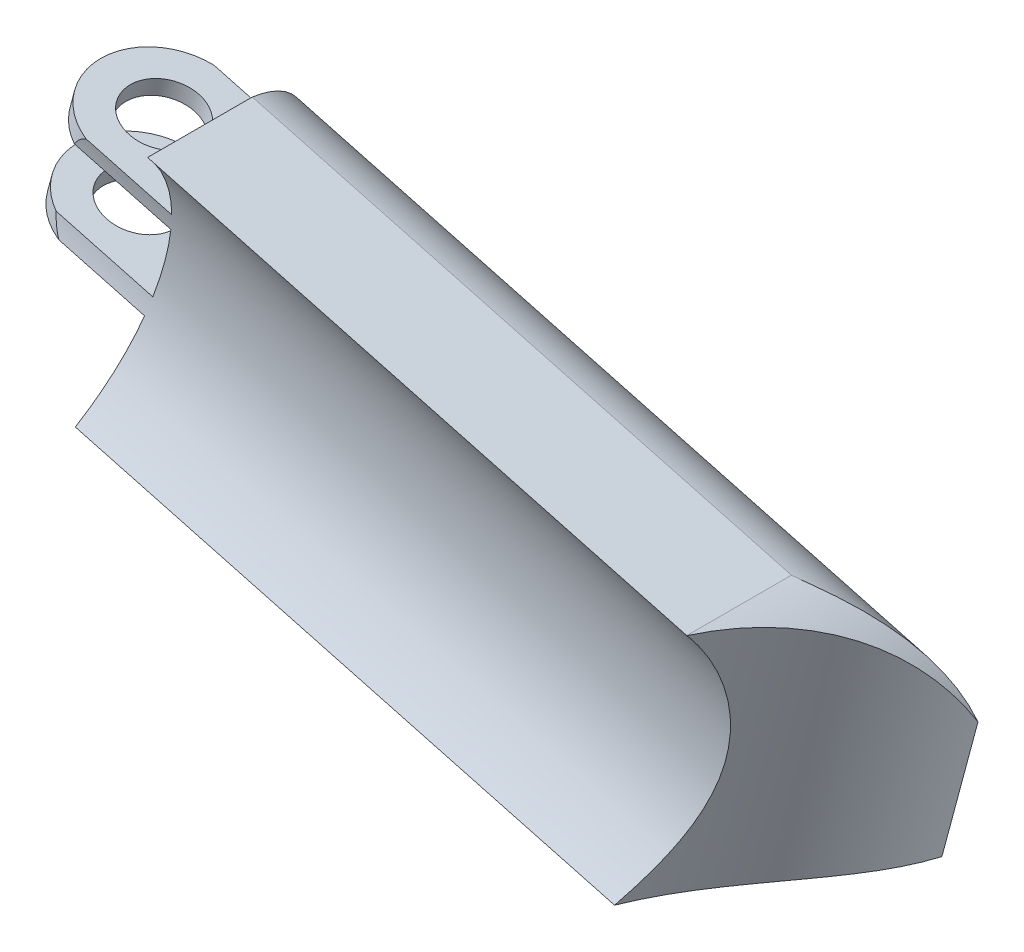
SolidWorks part; units mm, degrees
ref_plane "Front Plane" through (0, 0, 0) normal (0, 0, 1) x (1, 0, 0)
ref_plane "Top Plane" through (0, 0, 0) normal (0, 1, 0) x (1, 0, 0)
ref_plane "Right Plane" through (0, 0, 0) normal (1, 0, 0) x (0, 0, -1)
sketch "草图1" plane through (0, 0, 0) normal (0, 0, 1) x (1, 0, 0)
  line L0 (-16.6893, 10.3528) -> (21.9478, 0)
  line L1 (-16.6893, 10.3528) -> (-20.8304, -5.1021)
  line L2 (-20.8304, -5.1021) -> (17.8067, -15.4548)
  line L3 (17.8067, -15.4548) -> (21.9478, 0)
  dimension "D1" = 40
extrude "凸台-拉伸1" add sketch "草图1" along normal blind 10
sketch "草图2" plane through (-18.1595, 4.8658, 0) normal (-0.9659, 0.2588, 0) x (0, 0, 1)
  line L0 (0, 5.6805) -> (0, -10.3195) construction
  line L1 (10, 5.6805) -> (0, 5.6805) construction
  line L2 (10, -10.3195) -> (0, -10.3195) construction
  line L3 (4, 5.6805) -> (4, 12.3845)
  line L4 (4, 12.3845) -> (-14.9046, 12.3845)
  line L5 (-14.9046, 12.3845) -> (-14.9046, -20.0885)
  line L6 (-14.9046, -20.0885) -> (4, -20.0885)
  line L7 (4, -20.0885) -> (4, -10.3195)
  arc A0 (0, 1.6805) -> (4, 5.6805) centre (4.9155, 0.765) cw
  arc A1 (4, -10.3195) -> (0, -6.3195) centre (4.9155, -5.404) cw
  dimension "D1" = 4
  dimension "D3" = 4
  dimension "D2" = 4
extrude "切除-拉伸1" cut sketch "草图2" against normal blind 40 and the other way through all
sketch "草图3" plane through (-18.1595, 4.8658, 0) normal (-0.9659, 0.2588, 0) x (0, 0, 1)
  line L0 (10, 5.6805) -> (10, -10.3195)
  arc A0 (10, 5.6805) -> (10, -10.3195) centre (18.9443, -2.3195) ccw
extrude "切除-拉伸2" cut sketch "草图3" against normal blind 40
sketch "草图4" plane through (-18.1595, 4.8658, 0) normal (-0.9659, 0.2588, 0) x (0, 0, 1)
  line L0 (7.3253, 0.6805) -> (0, 0.6805)
  line L1 (0, 1.6805) -> (0, -6.3195) construction
  line L2 (0, 0.6805) -> (0, -0.3195)
  line L3 (0, -0.3195) -> (7.1121, -0.3195)
  line L4 (10, 5.6805) -> (4, 5.6805) construction
  line L5 (7.3253, -5.3195) -> (0, -5.3195)
  line L6 (0, -5.3195) -> (0, -4.3195)
  line L7 (0, -4.3195) -> (7.1121, -4.3195)
  line L8 (10, -10.3195) -> (4, -10.3195) construction
  arc A0 (10, 5.6805) -> (10, -10.3195) centre (18.9443, -2.3195) ccw construction
  arc A1 (7.3253, 0.6805) -> (7.1121, -0.3195) centre (18.9443, -2.3195) ccw
  arc A2 (7.1121, -4.3195) -> (7.3253, -5.3195) centre (18.9443, -2.3195) ccw
  dimension "D1" = 5
  dimension "D2" = 1
  dimension "D3" = 5
  dimension "D4" = 1
extrude "凸台-拉伸2" add sketch "草图4" along normal blind 8
sketch "草图5" plane through (0.1761, 0.6573, 0) normal (0.2588, 0.9659, 0) x (0.9659, -0.2588, 0)
  line L0 (-26.8001, 0) -> (-18.8001, 0) construction
  line L1 (-26.8001, -7.3253) -> (-18.8001, -7.3253) construction
  line L2 (-23.8788, 0) -> (-23.8788, 3.4629)
  line L3 (-23.8788, 3.4629) -> (-36.3546, 3.4629)
  line L4 (-36.3546, 3.4629) -> (-36.3546, -10.3241)
  line L5 (-36.3546, -10.3241) -> (-23.8788, -10.3241)
  line L6 (-23.8788, -10.3241) -> (-23.8788, -7.3253)
  arc A0 (-23.8788, 0) -> (-23.8788, -7.3253) centre (-23.0434, -3.6627) ccw
extrude "切除-拉伸3" cut sketch "草图5" against normal blind 10
sketch "草图6" plane through (0.1761, 0.6573, 0) normal (0.2588, 0.9659, 0) x (0.9659, -0.2588, 0)
  circle A0 centre (-23.0434, -3.6627) radius 2
  arc A1 (-23.8788, 0) -> (-23.8788, -7.3253) centre (-23.0434, -3.6627) ccw construction
  dimension "D1" = 0
extrude "切除-拉伸4" cut sketch "草图6" against normal blind 10
sketch "草图7" plane through (0, 0, 0) normal (0, 0, -1) x (-1, 0, 0)
  line L1 (20.8304, -5.1021) -> (-17.8067, -15.4548) construction
  line L4 (-16.3589, 9.9764) -> (-31.4418, 5.9091)
  line L5 (-31.4418, 5.9091) -> (-23.9003, -22.4104)
  line L6 (-23.9003, -22.4104) -> (-8.7157, -18.3667)
  line L9 (16.6893, 10.3528) -> (-21.9478, 0) construction
  line L10 (-21.9478, 0) -> (-20.9125, -3.8637) construction
  line L11 (-16.3589, 9.9764) -> (-14.2204, 2.0706)
  line L12 (-20.9125, -3.8637) -> (-18.8419, -11.5911)
  line L13 (-10.0792, -13.3843) -> (-8.7157, -18.3667)
  arc A2 (-18.8419, -11.5911) -> (-10.0792, -13.3843) centre (-12.2281, -1.5782) ccw
  arc A4 (-20.9125, -3.8637) -> (-14.2204, 2.0706) centre (-10.1783, -9.2282) cw
  dimension "D2" = 8
  dimension "D1" = 8
extrude "切除-拉伸5" cut sketch "草图7" against normal blind 10
sketch "草图8" plane through (1.4702, 5.4869, 0) normal (0.2588, 0.9659, 0) x (0.9659, -0.2588, 0)
  line L1 (13.1999, -10) -> (21.1999, -9.7144)
  line L2 (21.1999, -9.7144) -> (21.1999, 0)
  arc A0 (21.1999, 0) -> (13.1999, -10) centre (30.3362, -15.509) ccw
extrude "切除-拉伸6" cut sketch "草图8" against normal blind 16
